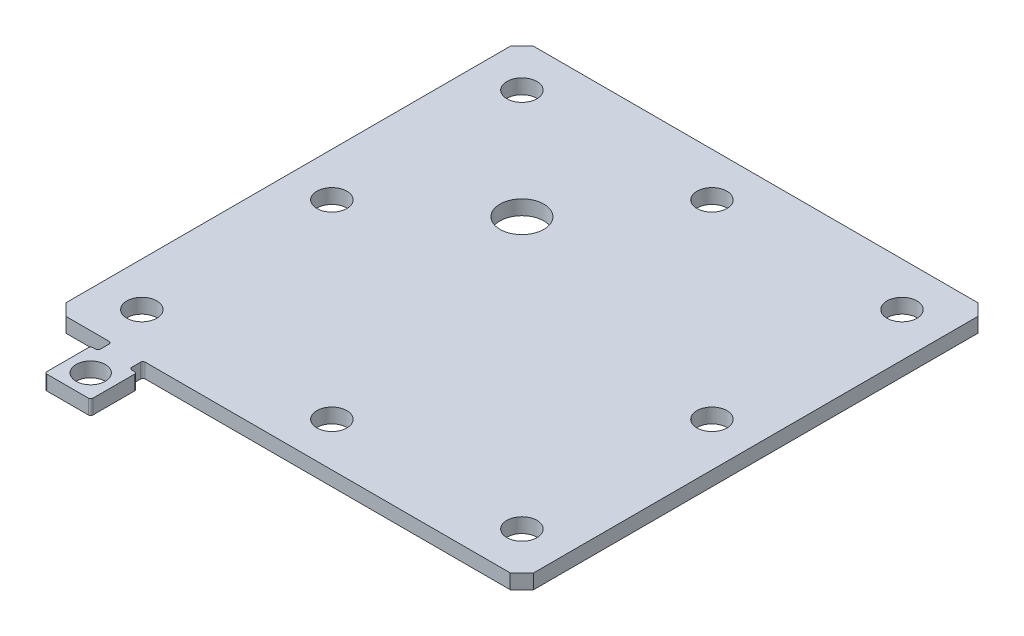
SolidWorks part; units mm, degrees
ref_plane "Front Plane" through (0, 0, 0) normal (0, 0, 1) x (1, 0, 0)
ref_plane "Top Plane" through (0, 0, 0) normal (0, 1, 0) x (1, 0, 0)
ref_plane "Right Plane" through (0, 0, 0) normal (1, 0, 0) x (0, 0, -1)
sketch "Sketch1" plane through (0, 0, 0) normal (0, 1, 0) x (1, 0, 0)
  line L0 (45.5122, -44.6509) -> (45.5122, -53.6509)
  line L1 (46.0122, -54.1509) -> (55.0122, -54.1509)
  line L2 (55.5122, -53.6509) -> (55.5122, -44.6509)
  line L3 (55.0122, -44.1509) -> (54.4247, -44.1509)
  line L4 (53.9247, -43.6509) -> (53.9247, -41.7128)
  line L5 (54.4247, -41.2128) -> (133.6972, -41.2128)
  line L6 (133.6972, -41.2128) -> (136.2372, -38.6728)
  line L7 (136.2372, -38.6728) -> (136.2372, 57.8472)
  line L8 (136.2372, 57.8472) -> (133.6972, 60.3872)
  line L9 (133.6972, 60.3872) -> (37.1772, 60.3872)
  line L10 (37.1772, 60.3872) -> (34.6372, 57.8472)
  line L11 (34.6372, 57.8472) -> (34.6372, -38.6728)
  line L12 (34.6372, -38.6728) -> (37.1772, -41.2128)
  line L13 (37.1772, -41.2128) -> (46.5997, -41.2128)
  line L14 (47.0997, -41.7128) -> (47.0997, -43.6509)
  line L15 (46.5997, -44.1509) -> (46.0122, -44.1509)
  line L16 (34.6372, 27.0497) -> (67.9747, 27.0497) construction
  line L17 (67.9747, 27.0497) -> (67.9747, 60.3872) construction
  line L18 (46.0122, -44.6509) -> (55.0122, -53.6509) construction
  line L19 (55.0122, -44.6509) -> (46.0122, -53.6509) construction
  arc A0 (45.5122, -53.6509) -> (46.0122, -54.1509) centre (46.0122, -53.6509) ccw
  arc A1 (55.0122, -54.1509) -> (55.5122, -53.6509) centre (55.0122, -53.6509) ccw
  arc A2 (55.5122, -44.6509) -> (55.0122, -44.1509) centre (55.0122, -44.6509) ccw
  arc A3 (53.9247, -43.6509) -> (54.4247, -44.1509) centre (54.4247, -43.6509) ccw
  arc A4 (54.4247, -41.2128) -> (53.9247, -41.7128) centre (54.4247, -41.7128) ccw
  arc A5 (47.0997, -41.7128) -> (46.5997, -41.2128) centre (46.5997, -41.7128) ccw
  arc A6 (46.5997, -44.1509) -> (47.0997, -43.6509) centre (46.5997, -43.6509) ccw
  arc A7 (46.0122, -44.1509) -> (45.5122, -44.6509) centre (46.0122, -44.6509) ccw
  circle A8 centre (44.1622, 9.5872) radius 3.2639
  circle A9 centre (44.1622, -31.6878) radius 3.2639
  circle A10 centre (85.4372, -31.6878) radius 3.2639
  circle A11 centre (126.7122, -31.6878) radius 3.2639
  circle A12 centre (126.7122, 9.5872) radius 3.2639
  circle A13 centre (126.7122, 50.8622) radius 3.2639
  circle A14 centre (85.4372, 50.8622) radius 3.2639
  circle A16 centre (44.1622, 50.8622) radius 3.2639
  circle A17 centre (67.9747, 27.0497) radius 4.7625
  circle A18 centre (50.5122, -49.1509) radius 3.175
  dimension "D3" = 9.525
  dimension "D4" = 6.35
  dimension "D1" = 33.3375
  dimension "D2" = 33.3375
extrude "Boss-Extrude1" add sketch "Sketch1" along normal blind 3.175
